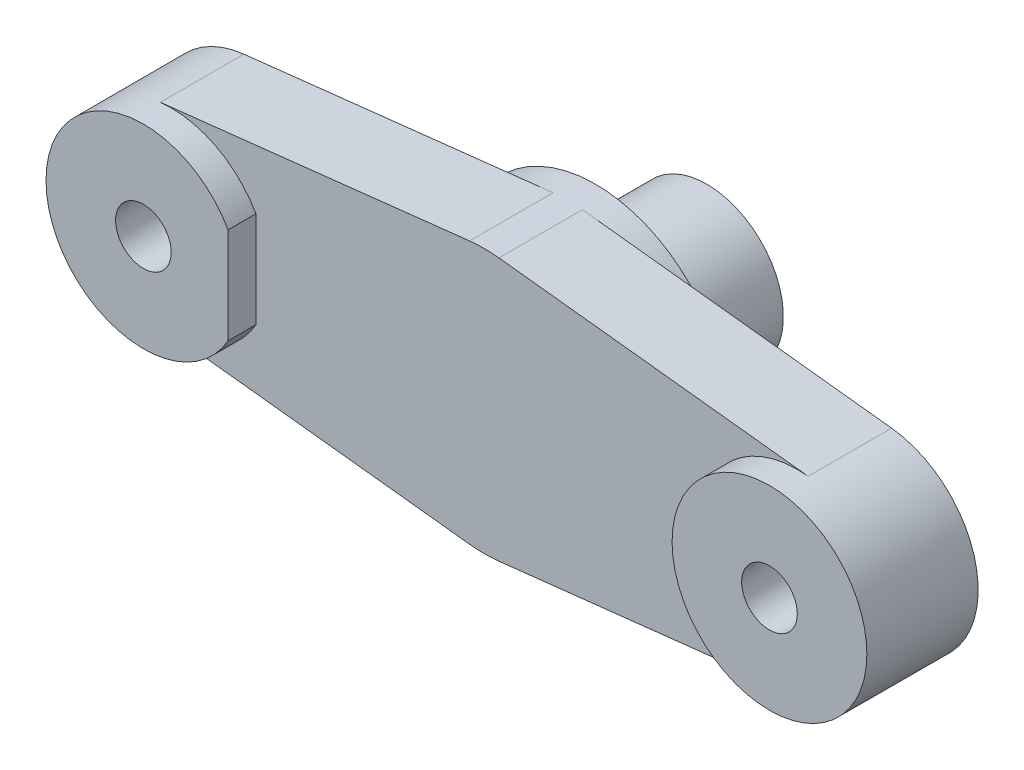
SolidWorks part; units mm, degrees
ref_plane "Face" through (0, 0, 0) normal (0, 0, 1) x (1, 0, 0)
ref_plane "Dessus" through (0, 0, 0) normal (0, 1, 0) x (1, 0, 0)
ref_plane "Droite" through (0, 0, 0) normal (1, 0, 0) x (0, 0, -1)
sketch "Esquisse1" plane through (0, 0, 0) normal (0, 0, 1) x (1, 0, 0)
  line L0 (-46.5556, 13.9133) -> (-2.1111, 18.8824)
  line L1 (-46.5556, -13.9133) -> (-2.1111, -18.8824)
  line L2 (2.1111, -18.8824) -> (46.5556, -13.9133)
  line L3 (2.1111, 18.8824) -> (46.5556, 13.9133)
  arc A0 (2.1111, 18.8824) -> (-2.1111, 18.8824) centre (0, 0) ccw
  arc A1 (-46.5556, 13.9133) -> (-46.5556, -13.9133) centre (-45, 0) ccw
  arc A2 (46.5556, -13.9133) -> (46.5556, 13.9133) centre (45, 0) ccw
  arc A3 (-2.1111, -18.8824) -> (2.1111, -18.8824) centre (0, 0) ccw
  dimension "D3" = 28
  dimension "D4" = 28
  dimension "D5" = 38
  dimension "D1" = 45
  dimension "D2" = 45
extrude "Base-Extrusion" add sketch "Esquisse1" along normal blind 12
sketch "Esquisse2" plane through (0, 0, 12) normal (0, 0, 1) x (1, 0, 0)
  line L0 (-32.8207, 6.9039) -> (-32.8207, -6.9039)
  arc A0 (-32.8207, 6.9039) -> (-32.8207, -6.9039) centre (-45, 0) ccw
  circle A1 centre (45, 0) radius 14
extrude "Boss.-Extru.1" add sketch "Esquisse2" along normal blind 4
sketch "Esquisse3" plane through (0, 0, 0) normal (0, 0, -1) x (-1, 0, 0)
  circle A0 centre (0, 0) radius 19
  dimension "D1" = 38
extrude "Boss.-Extru.2" add sketch "Esquisse3" along normal blind 4
sketch "Esquisse4" plane through (0, 0, -4) normal (0, 0, -1) x (-1, 0, 0)
  circle A0 centre (0, 0) radius 11
  dimension "D1" = 22
extrude "Boss.-Extru.3" add sketch "Esquisse4" along normal blind 16
sketch "Esquisse5" plane through (0, 0, 16) normal (0, 0, 1) x (1, 0, 0)
  circle A0 centre (-45, 0) radius 4
  circle A1 centre (45, 0) radius 4
  dimension "D1" = 8
  dimension "D2" = 8
extrude "Enlèv. mat.-Extru.1" cut sketch "Esquisse5" against normal through all
sketch "Esquisse6" plane through (0, 0, 0) normal (0, 0, -1) x (-1, 0, 0)
  circle A0 centre (-45, 0) radius 7.5
  circle A1 centre (45, 0) radius 7.5
  dimension "D1" = 15
  dimension "D2" = 15
extrude "Enlèv. mat.-Extru.2" cut sketch "Esquisse6" against normal blind 8
